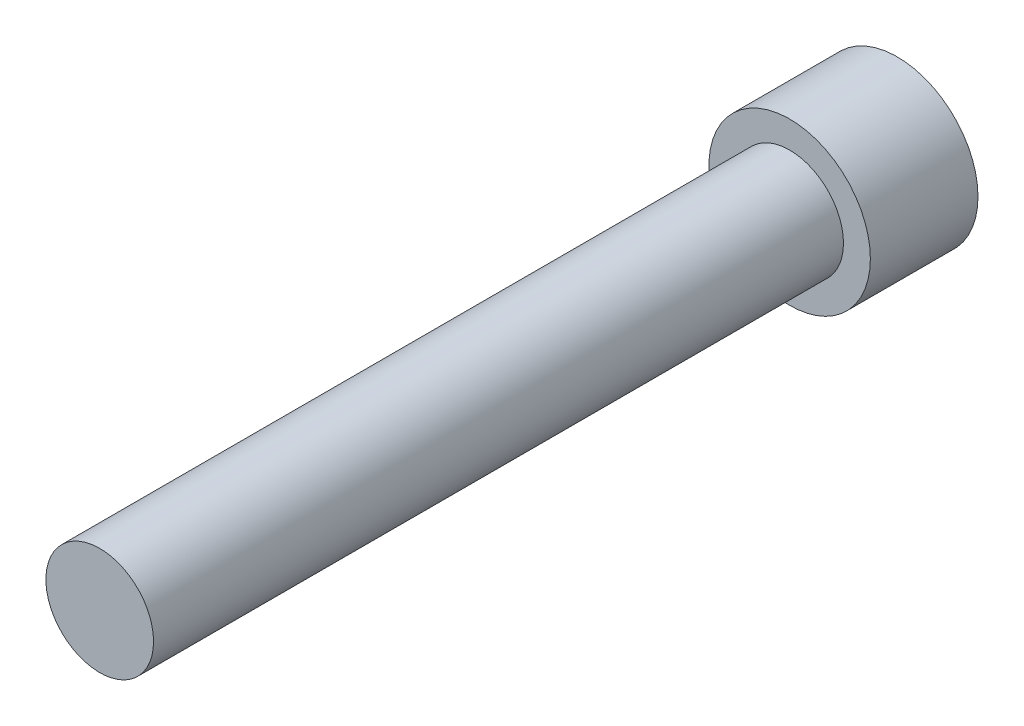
SolidWorks part; units mm, degrees
ref_plane "Front Plane" through (0, 0, 0) normal (0, 0, 1) x (1, 0, 0)
ref_plane "Top Plane" through (0, 0, 0) normal (0, 1, 0) x (1, 0, 0)
ref_plane "Right Plane" through (0, 0, 0) normal (1, 0, 0) x (0, 0, -1)
sketch "Sketch6" plane through (0, 0, 0) normal (1, 0, 0) x (0, 0, -1)
  line L0 (-50.8, 0) -> (22.525, 0) construction
  line L1 (6.538, 0) -> (-6.538, 0) construction
  line L2 (-50.8, 0) -> (-50.8, -3.9624)
  line L3 (-50.8, -3.9624) -> (0, -3.9624)
  line L4 (0, 6.538) -> (0, -6.538) construction
  line L5 (0, -3.9624) -> (0, -5.9436)
  line L6 (0, -5.9436) -> (7.9248, -5.9436)
  line L7 (7.9248, -5.9436) -> (7.9248, 0)
  line L8 (7.9248, 0) -> (-50.8, 0)
  dimension "L" = 50.8
  dimension "H" = 7.9248
  dimension "A" = 11.8872
  dimension "D" = 7.9248
revolve "Revolve1" add sketch "Sketch6" angle 360 about L0
sketch "Sketch7" plane through (0, 0, -7.9248) normal (0, 0, -1) x (-1, 0, 0)
  line L2 (-3.175, 1.8331) -> (-3.175, -1.8331)
  line L4 (-3.175, -1.8331) -> (0, -3.6662)
  line L5 (0, -3.6662) -> (3.175, -1.8331)
  line L6 (3.175, -1.8331) -> (3.175, 1.8331)
  line L7 (3.175, 1.8331) -> (0, 3.6662)
  line L8 (0, 3.6662) -> (-3.175, 1.8331)
  circle A0 centre (0, 0) radius 3.175 construction
  dimension "J" = 6.35
extrude "HEX" cut sketch "Sketch7" against normal blind 4.826
